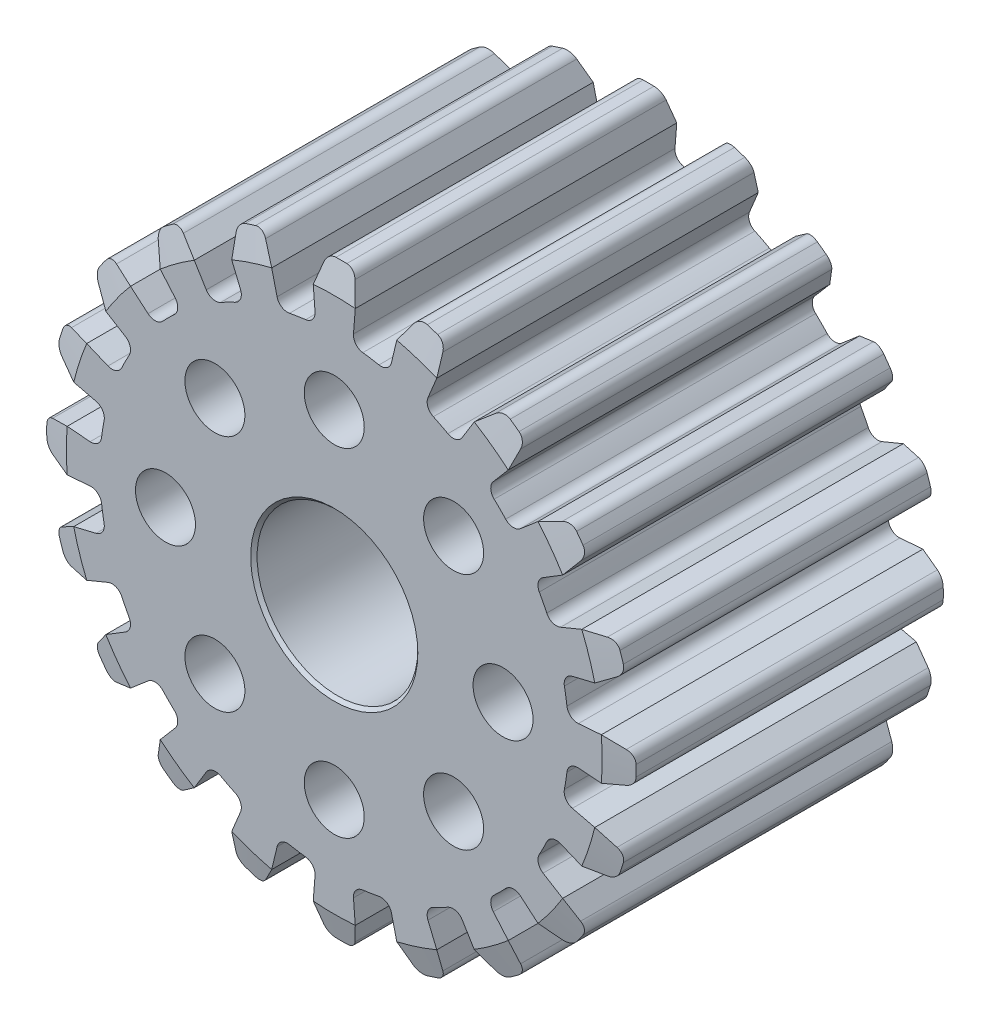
SolidWorks part; units mm, degrees
ref_plane "Front X-Y" through (0, 0, 0) normal (0, 0, 1) x (1, 0, 0)
ref_plane "Top X-Z" through (0, 0, 0) normal (0, 1, 0) x (1, 0, 0)
ref_plane "Right Y-Z" through (0, 0, 0) normal (1, 0, 0) x (0, 0, -1)
ref_plane "Plane1" through (0, 0, 0) normal (1, 0, 0) x (0, 0, -1)
sketch "Sketch1" plane through (0, 0, 0) normal (1, 0, 0) x (0, 0, -1)
  line L0 (-30, 25) -> (-30, 7.8)
  line L1 (-30, 7.8) -> (-29.7, 7.5)
  line L2 (-29.7, 7.5) -> (-0.3, 7.5)
  line L3 (-0.3, 7.5) -> (0, 7.8)
  line L4 (0, 7.8) -> (0, 25)
  line L5 (0, 25) -> (-1.2058, 29.5)
  line L6 (-1.2058, 29.5) -> (-28.7942, 29.5)
  line L7 (-28.7942, 29.5) -> (-30, 25)
  line L8 (0, 0) -> (-30, 0) construction
revolve "Revolve1" add sketch "Sketch1" angle 360 about L8
ref_plane "Plane2" through (0, 0, 0) normal (0, 0, 1) x (1, 0, 0)
sketch "Sketch2" plane through (0, 0, 0) normal (0, 0, 1) x (1, 0, 0)
  line L0 (-26.7628, -1.4513) -> (-24.9229, -1.9615)
  line L1 (-24.9229, -1.9615) -> (-22.7827, -1.793)
  line L2 (-22.2217, -5.335) -> (-24.3092, -5.8361)
  line L3 (-24.3092, -5.8361) -> (-25.9014, -6.8899)
  line L4 (-25.0044, -9.6504) -> (-23.097, -9.5671)
  line L5 (-23.097, -9.5671) -> (-21.1135, -8.7455)
  line L6 (-19.4855, -11.9407) -> (-21.316, -13.0625)
  line L7 (-21.316, -13.0625) -> (-22.5045, -14.5567)
  line L8 (-20.7985, -16.9048) -> (-19.0101, -16.2362)
  line L9 (-19.0101, -16.2362) -> (-17.3777, -14.8419)
  line L10 (-14.8419, -17.3777) -> (-16.2362, -19.0101)
  line L11 (-16.2362, -19.0101) -> (-16.9048, -20.7985)
  line L12 (-14.5567, -22.5045) -> (-13.0625, -21.316)
  line L13 (-13.0625, -21.316) -> (-11.9407, -19.4855)
  line L14 (-8.7455, -21.1135) -> (-9.5671, -23.097)
  line L15 (-9.5671, -23.097) -> (-9.6504, -25.0044)
  line L16 (-6.8899, -25.9014) -> (-5.8361, -24.3092)
  line L17 (-5.8361, -24.3092) -> (-5.335, -22.2217)
  line L18 (-1.793, -22.7827) -> (-1.9615, -24.9229)
  line L19 (-1.9615, -24.9229) -> (-1.4513, -26.7628)
  line L20 (1.4513, -26.7628) -> (1.9615, -24.9229)
  line L21 (1.9615, -24.9229) -> (1.793, -22.7827)
  line L22 (5.335, -22.2217) -> (5.8361, -24.3092)
  line L23 (5.8361, -24.3092) -> (6.8899, -25.9014)
  line L24 (9.6504, -25.0044) -> (9.5671, -23.097)
  line L25 (9.5671, -23.097) -> (8.7455, -21.1135)
  line L26 (11.9407, -19.4855) -> (13.0625, -21.316)
  line L27 (13.0625, -21.316) -> (14.5567, -22.5045)
  line L28 (16.9048, -20.7985) -> (16.2362, -19.0101)
  line L29 (16.2362, -19.0101) -> (14.8419, -17.3777)
  line L30 (17.3777, -14.8419) -> (19.0101, -16.2362)
  line L31 (19.0101, -16.2362) -> (20.7985, -16.9048)
  line L32 (22.5045, -14.5567) -> (21.316, -13.0625)
  line L33 (21.316, -13.0625) -> (19.4855, -11.9407)
  line L34 (21.1135, -8.7455) -> (23.097, -9.5671)
  line L35 (23.097, -9.5671) -> (25.0044, -9.6504)
  line L36 (25.9014, -6.8899) -> (24.3092, -5.8361)
  line L37 (24.3092, -5.8361) -> (22.2217, -5.335)
  line L38 (22.7827, -1.793) -> (24.9229, -1.9615)
  line L39 (24.9229, -1.9615) -> (26.7628, -1.4513)
  line L40 (26.7628, 1.4513) -> (24.9229, 1.9615)
  line L41 (24.9229, 1.9615) -> (22.7827, 1.793)
  line L42 (22.2217, 5.335) -> (24.3092, 5.8361)
  line L43 (24.3092, 5.8361) -> (25.9014, 6.8899)
  line L44 (25.0044, 9.6504) -> (23.097, 9.5671)
  line L45 (23.097, 9.5671) -> (21.1135, 8.7455)
  line L46 (19.4855, 11.9407) -> (21.316, 13.0625)
  line L47 (21.316, 13.0625) -> (22.5045, 14.5567)
  line L48 (20.7985, 16.9048) -> (19.0101, 16.2362)
  line L49 (19.0101, 16.2362) -> (17.3777, 14.8419)
  line L50 (14.8419, 17.3777) -> (16.2362, 19.0101)
  line L51 (16.2362, 19.0101) -> (16.9048, 20.7985)
  line L52 (14.5567, 22.5045) -> (13.0625, 21.316)
  line L53 (13.0625, 21.316) -> (11.9407, 19.4855)
  line L54 (8.7455, 21.1135) -> (9.5671, 23.097)
  line L55 (9.5671, 23.097) -> (9.6504, 25.0044)
  line L56 (6.8899, 25.9014) -> (5.8361, 24.3092)
  line L57 (5.8361, 24.3092) -> (5.335, 22.2217)
  line L58 (1.793, 22.7827) -> (1.9615, 24.9229)
  line L59 (1.9615, 24.9229) -> (1.4513, 26.7628)
  line L60 (-1.4513, 26.7628) -> (-1.9615, 24.9229)
  line L61 (-1.9615, 24.9229) -> (-1.793, 22.7827)
  line L62 (-5.335, 22.2217) -> (-5.8361, 24.3092)
  line L63 (-5.8361, 24.3092) -> (-6.8899, 25.9014)
  line L64 (-9.6504, 25.0044) -> (-9.5671, 23.097)
  line L65 (-9.5671, 23.097) -> (-8.7455, 21.1135)
  line L66 (-11.9407, 19.4855) -> (-13.0625, 21.316)
  line L67 (-13.0625, 21.316) -> (-14.5567, 22.5045)
  line L68 (-16.9048, 20.7985) -> (-16.2362, 19.0101)
  line L69 (-16.2362, 19.0101) -> (-14.8419, 17.3777)
  line L70 (-17.3777, 14.8419) -> (-19.0101, 16.2362)
  line L71 (-19.0101, 16.2362) -> (-20.7985, 16.9048)
  line L72 (-22.5045, 14.5567) -> (-21.316, 13.0625)
  line L73 (-21.316, 13.0625) -> (-19.4855, 11.9407)
  line L74 (-21.1135, 8.7455) -> (-23.097, 9.5671)
  line L75 (-23.097, 9.5671) -> (-25.0044, 9.6504)
  line L76 (-25.9014, 6.8899) -> (-24.3092, 5.8361)
  line L77 (-24.3092, 5.8361) -> (-22.2217, 5.335)
  line L78 (-22.7827, 1.793) -> (-24.9229, 1.9615)
  line L79 (-24.9229, 1.9615) -> (-26.7628, 1.4513)
  circle A0 centre (0, 0) radius 32.5
  arc A1 (-27.4953, 0.506) -> (-27.4953, -0.506) centre (0, 0) ccw
  arc A2 (-27.4953, -0.506) -> (-26.7628, -1.4513) centre (-26.4955, -0.4876) ccw
  arc A3 (-22.7827, -1.793) -> (-21.7117, -2.668) centre (-22.7042, -2.79) cw
  arc A4 (-21.7117, -2.668) -> (-21.4735, -4.1719) centre (0, 0) ccw
  arc A5 (-21.4735, -4.1719) -> (-22.2217, -5.335) centre (-22.4551, -4.3626) cw
  arc A6 (-25.9014, -6.8899) -> (-26.306, -8.0153) centre (-25.3494, -7.7238) ccw
  arc A7 (-26.306, -8.0153) -> (-25.9933, -8.9778) centre (0, 0) ccw
  arc A8 (-25.9933, -8.9778) -> (-25.0044, -9.6504) centre (-25.048, -8.6513) ccw
  arc A9 (-21.1135, -8.7455) -> (-19.8246, -9.2467) centre (-20.7309, -9.6694) cw
  arc A10 (-19.8246, -9.2467) -> (-19.1333, -10.6034) centre (0, 0) ccw
  arc A11 (-19.1333, -10.6034) -> (-19.4855, -11.9407) centre (-20.008, -11.0881) cw
  arc A12 (-22.5045, -14.5567) -> (-22.5416, -15.752) centre (-21.7219, -15.1792) ccw
  arc A13 (-22.5416, -15.752) -> (-21.9468, -16.5707) centre (0, 0) ccw
  arc A14 (-21.9468, -16.5707) -> (-20.7985, -16.9048) centre (-21.1487, -15.9682) ccw
  arc A15 (-17.3777, -14.8419) -> (-15.9969, -14.9203) centre (-16.7282, -15.6023) cw
  arc A16 (-15.9969, -14.9203) -> (-14.9203, -15.9969) centre (0, 0) ccw
  arc A17 (-14.9203, -15.9969) -> (-14.8419, -17.3777) centre (-15.6023, -16.7282) cw
  arc A18 (-16.9048, -20.7985) -> (-16.5707, -21.9468) centre (-15.9682, -21.1487) ccw
  arc A19 (-16.5707, -21.9468) -> (-15.752, -22.5416) centre (0, 0) ccw
  arc A20 (-15.752, -22.5416) -> (-14.5567, -22.5045) centre (-15.1792, -21.7219) ccw
  arc A21 (-11.9407, -19.4855) -> (-10.6034, -19.1333) centre (-11.0881, -20.008) cw
  arc A22 (-10.6034, -19.1333) -> (-9.2467, -19.8246) centre (0, 0) ccw
  arc A23 (-9.2467, -19.8246) -> (-8.7455, -21.1135) centre (-9.6694, -20.7309) cw
  arc A24 (-9.6504, -25.0044) -> (-8.9778, -25.9933) centre (-8.6513, -25.048) ccw
  arc A25 (-8.9778, -25.9933) -> (-8.0153, -26.306) centre (0, 0) ccw
  arc A26 (-8.0153, -26.306) -> (-6.8899, -25.9014) centre (-7.7238, -25.3494) ccw
  arc A27 (-5.335, -22.2217) -> (-4.1719, -21.4735) centre (-4.3626, -22.4551) cw
  arc A28 (-4.1719, -21.4735) -> (-2.668, -21.7117) centre (0, 0) ccw
  arc A29 (-2.668, -21.7117) -> (-1.793, -22.7827) centre (-2.79, -22.7042) cw
  arc A30 (-1.4513, -26.7628) -> (-0.506, -27.4953) centre (-0.4876, -26.4955) ccw
  arc A31 (-0.506, -27.4953) -> (0.506, -27.4953) centre (0, 0) ccw
  arc A32 (0.506, -27.4953) -> (1.4513, -26.7628) centre (0.4876, -26.4955) ccw
  arc A33 (1.793, -22.7827) -> (2.668, -21.7117) centre (2.79, -22.7042) cw
  arc A34 (2.668, -21.7117) -> (4.1719, -21.4735) centre (0, 0) ccw
  arc A35 (4.1719, -21.4735) -> (5.335, -22.2217) centre (4.3626, -22.4551) cw
  arc A36 (6.8899, -25.9014) -> (8.0153, -26.306) centre (7.7238, -25.3494) ccw
  arc A37 (8.0153, -26.306) -> (8.9778, -25.9933) centre (0, 0) ccw
  arc A38 (8.9778, -25.9933) -> (9.6504, -25.0044) centre (8.6513, -25.048) ccw
  arc A39 (8.7455, -21.1135) -> (9.2467, -19.8246) centre (9.6694, -20.7309) cw
  arc A40 (9.2467, -19.8246) -> (10.6034, -19.1333) centre (0, 0) ccw
  arc A41 (10.6034, -19.1333) -> (11.9407, -19.4855) centre (11.0881, -20.008) cw
  arc A42 (14.5567, -22.5045) -> (15.752, -22.5416) centre (15.1792, -21.7219) ccw
  arc A43 (15.752, -22.5416) -> (16.5707, -21.9468) centre (0, 0) ccw
  arc A44 (16.5707, -21.9468) -> (16.9048, -20.7985) centre (15.9682, -21.1487) ccw
  arc A45 (14.8419, -17.3777) -> (14.9203, -15.9969) centre (15.6023, -16.7282) cw
  arc A46 (14.9203, -15.9969) -> (15.9969, -14.9203) centre (0, 0) ccw
  arc A47 (15.9969, -14.9203) -> (17.3777, -14.8419) centre (16.7282, -15.6023) cw
  arc A48 (20.7985, -16.9048) -> (21.9468, -16.5707) centre (21.1487, -15.9682) ccw
  arc A49 (21.9468, -16.5707) -> (22.5416, -15.752) centre (0, 0) ccw
  arc A50 (22.5416, -15.752) -> (22.5045, -14.5567) centre (21.7219, -15.1792) ccw
  arc A51 (19.4855, -11.9407) -> (19.1333, -10.6034) centre (20.008, -11.0881) cw
  arc A52 (19.1333, -10.6034) -> (19.8246, -9.2467) centre (0, 0) ccw
  arc A53 (19.8246, -9.2467) -> (21.1135, -8.7455) centre (20.7309, -9.6694) cw
  arc A54 (25.0044, -9.6504) -> (25.9933, -8.9778) centre (25.048, -8.6513) ccw
  arc A55 (25.9933, -8.9778) -> (26.306, -8.0153) centre (0, 0) ccw
  arc A56 (26.306, -8.0153) -> (25.9014, -6.8899) centre (25.3494, -7.7238) ccw
  arc A57 (22.2217, -5.335) -> (21.4735, -4.1719) centre (22.4551, -4.3626) cw
  arc A58 (21.4735, -4.1719) -> (21.7117, -2.668) centre (0, 0) ccw
  arc A59 (21.7117, -2.668) -> (22.7827, -1.793) centre (22.7042, -2.79) cw
  arc A60 (26.7628, -1.4513) -> (27.4953, -0.506) centre (26.4955, -0.4876) ccw
  arc A61 (27.4953, -0.506) -> (27.4953, 0.506) centre (0, 0) ccw
  arc A62 (27.4953, 0.506) -> (26.7628, 1.4513) centre (26.4955, 0.4876) ccw
  arc A63 (22.7827, 1.793) -> (21.7117, 2.668) centre (22.7042, 2.79) cw
  arc A64 (21.7117, 2.668) -> (21.4735, 4.1719) centre (0, 0) ccw
  arc A65 (21.4735, 4.1719) -> (22.2217, 5.335) centre (22.4551, 4.3626) cw
  arc A66 (25.9014, 6.8899) -> (26.306, 8.0153) centre (25.3494, 7.7238) ccw
  arc A67 (26.306, 8.0153) -> (25.9933, 8.9778) centre (0, 0) ccw
  arc A68 (25.9933, 8.9778) -> (25.0044, 9.6504) centre (25.048, 8.6513) ccw
  arc A69 (21.1135, 8.7455) -> (19.8246, 9.2467) centre (20.7309, 9.6694) cw
  arc A70 (19.8246, 9.2467) -> (19.1333, 10.6034) centre (0, 0) ccw
  arc A71 (19.1333, 10.6034) -> (19.4855, 11.9407) centre (20.008, 11.0881) cw
  arc A72 (22.5045, 14.5567) -> (22.5416, 15.752) centre (21.7219, 15.1792) ccw
  arc A73 (22.5416, 15.752) -> (21.9468, 16.5707) centre (0, 0) ccw
  arc A74 (21.9468, 16.5707) -> (20.7985, 16.9048) centre (21.1487, 15.9682) ccw
  arc A75 (17.3777, 14.8419) -> (15.9969, 14.9203) centre (16.7282, 15.6023) cw
  arc A76 (15.9969, 14.9203) -> (14.9203, 15.9969) centre (0, 0) ccw
  arc A77 (14.9203, 15.9969) -> (14.8419, 17.3777) centre (15.6023, 16.7282) cw
  arc A78 (16.9048, 20.7985) -> (16.5707, 21.9468) centre (15.9682, 21.1487) ccw
  arc A79 (16.5707, 21.9468) -> (15.752, 22.5416) centre (0, 0) ccw
  arc A80 (15.752, 22.5416) -> (14.5567, 22.5045) centre (15.1792, 21.7219) ccw
  arc A81 (11.9407, 19.4855) -> (10.6034, 19.1333) centre (11.0881, 20.008) cw
  arc A82 (10.6034, 19.1333) -> (9.2467, 19.8246) centre (0, 0) ccw
  arc A83 (9.2467, 19.8246) -> (8.7455, 21.1135) centre (9.6694, 20.7309) cw
  arc A84 (9.6504, 25.0044) -> (8.9778, 25.9933) centre (8.6513, 25.048) ccw
  arc A85 (8.9778, 25.9933) -> (8.0153, 26.306) centre (0, 0) ccw
  arc A86 (8.0153, 26.306) -> (6.8899, 25.9014) centre (7.7238, 25.3494) ccw
  arc A87 (5.335, 22.2217) -> (4.1719, 21.4735) centre (4.3626, 22.4551) cw
  arc A88 (4.1719, 21.4735) -> (2.668, 21.7117) centre (0, 0) ccw
  arc A89 (2.668, 21.7117) -> (1.793, 22.7827) centre (2.79, 22.7042) cw
  arc A90 (1.4513, 26.7628) -> (0.506, 27.4953) centre (0.4876, 26.4955) ccw
  arc A91 (0.506, 27.4953) -> (-0.506, 27.4953) centre (0, 0) ccw
  arc A92 (-0.506, 27.4953) -> (-1.4513, 26.7628) centre (-0.4876, 26.4955) ccw
  arc A93 (-1.793, 22.7827) -> (-2.668, 21.7117) centre (-2.79, 22.7042) cw
  arc A94 (-2.668, 21.7117) -> (-4.1719, 21.4735) centre (0, 0) ccw
  arc A95 (-4.1719, 21.4735) -> (-5.335, 22.2217) centre (-4.3626, 22.4551) cw
  arc A96 (-6.8899, 25.9014) -> (-8.0153, 26.306) centre (-7.7238, 25.3494) ccw
  arc A97 (-8.0153, 26.306) -> (-8.9778, 25.9933) centre (0, 0) ccw
  arc A98 (-8.9778, 25.9933) -> (-9.6504, 25.0044) centre (-8.6513, 25.048) ccw
  arc A99 (-8.7455, 21.1135) -> (-9.2467, 19.8246) centre (-9.6694, 20.7309) cw
  arc A100 (-9.2467, 19.8246) -> (-10.6034, 19.1333) centre (0, 0) ccw
  arc A101 (-10.6034, 19.1333) -> (-11.9407, 19.4855) centre (-11.0881, 20.008) cw
  arc A102 (-14.5567, 22.5045) -> (-15.752, 22.5416) centre (-15.1792, 21.7219) ccw
  arc A103 (-15.752, 22.5416) -> (-16.5707, 21.9468) centre (0, 0) ccw
  arc A104 (-16.5707, 21.9468) -> (-16.9048, 20.7985) centre (-15.9682, 21.1487) ccw
  arc A105 (-14.8419, 17.3777) -> (-14.9203, 15.9969) centre (-15.6023, 16.7282) cw
  arc A106 (-14.9203, 15.9969) -> (-15.9969, 14.9203) centre (0, 0) ccw
  arc A107 (-15.9969, 14.9203) -> (-17.3777, 14.8419) centre (-16.7282, 15.6023) cw
  arc A108 (-20.7985, 16.9048) -> (-21.9468, 16.5707) centre (-21.1487, 15.9682) ccw
  arc A109 (-21.9468, 16.5707) -> (-22.5416, 15.752) centre (0, 0) ccw
  arc A110 (-22.5416, 15.752) -> (-22.5045, 14.5567) centre (-21.7219, 15.1792) ccw
  arc A111 (-19.4855, 11.9407) -> (-19.1333, 10.6034) centre (-20.008, 11.0881) cw
  arc A112 (-19.1333, 10.6034) -> (-19.8246, 9.2467) centre (0, 0) ccw
  arc A113 (-19.8246, 9.2467) -> (-21.1135, 8.7455) centre (-20.7309, 9.6694) cw
  arc A114 (-25.0044, 9.6504) -> (-25.9933, 8.9778) centre (-25.048, 8.6513) ccw
  arc A115 (-25.9933, 8.9778) -> (-26.306, 8.0153) centre (0, 0) ccw
  arc A116 (-26.306, 8.0153) -> (-25.9014, 6.8899) centre (-25.3494, 7.7238) ccw
  arc A117 (-22.2217, 5.335) -> (-21.4735, 4.1719) centre (-22.4551, 4.3626) cw
  arc A118 (-21.4735, 4.1719) -> (-21.7117, 2.668) centre (0, 0) ccw
  arc A119 (-21.7117, 2.668) -> (-22.7827, 1.793) centre (-22.7042, 2.79) cw
  arc A120 (-26.7628, 1.4513) -> (-27.4953, 0.506) centre (-26.4955, 0.4876) ccw
extrude "Cut-Extrude1" cut sketch "Sketch2" along normal blind 30
ref_plane "Plane3" through (0, 0, 0) normal (1, 0, 0) x (0, 0, -1)
sketch "Sketch3" plane through (0, 0, 0) normal (1, 0, 0) x (0, 0, -1)
  line L0 (-3, 0) -> (-3, 20)
  line L1 (-3, 20) -> (0, 20)
  line L2 (0, 20) -> (0, 0)
  line L3 (0, 0) -> (-3, 0)
  line L4 (0, 0) -> (-3, 0) construction
  line L5 (0, 0) -> (13.7366, 0) construction
  line L6 (0, -7.8) -> (0, 7.8) construction
  dimension "D1" = 3
  dimension "D2" = 40
revolve "Cut-Revolve1" cut sketch "Sketch3" angle 360 about L4
hole_wizard "M5 Clearance Hole1" positions "Sketch5" profile "Sketch4" hole size "M5" standard "ANSI Metric"
sketch "Sketch5" plane through (0, 0, 30) normal (0, 0, 1) x (1, 0, 0)
  circle A0 centre (0, 0) radius 15.75 construction
  point P0 (0, -15.75)
  dimension "D1" = 31.5
sketch "Sketch4" plane through (0, -15.75, 30) normal (1, 0, 0) x (0, -1, 0)
  line L0 (0, 0) -> (0, 27.001)
  line L1 (0, 27.001) -> (2.8, 27.001)
  line L2 (2.8, 27.001) -> (2.8, 0)
  line L5 (2.8, 0) -> (0, 0)
  line L11 (0, -6.35) -> (0, 107.95) construction
  dimension "Thru Hole Dia." = 5.6
  dimension "Thru Hole Depth" = 27.001
pattern_circular "CirPattern1" count 8 over 360 about axis through (0, 0, 0) along (0, 0, 1) of "M5 Clearance Hole1"
sketch "Sketch6" plane through (0, 0, 0) normal (0, 0, -1) x (-1, 0, 0)
  circle A0 centre (0, 0) radius 25
  dimension "D1" = 50
